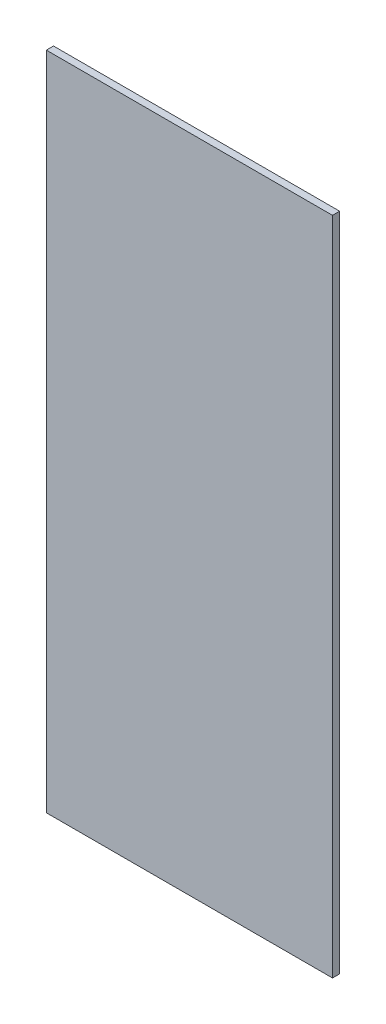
SolidWorks part; units mm, degrees
ref_plane "Alzado" through (0, 0, 0) normal (0, 0, 1) x (1, 0, 0)
ref_plane "Planta" through (0, 0, 0) normal (0, 1, 0) x (1, 0, 0)
ref_plane "Vista lateral" through (0, 0, 0) normal (1, 0, 0) x (0, 0, -1)
sketch "Croquis1" plane through (0, 0, 0) normal (0, 0, 1) x (1, 0, 0)
  line L1 (-300, 692.5) -> (300, 692.5)
  line L2 (-300, 692.5) -> (-300, -692.5)
  line L3 (-300, -692.5) -> (300, -692.5)
  line L4 (300, 692.5) -> (300, -692.5)
  line L5 (-300, 692.5) -> (300, -692.5) construction
  line L6 (-300, -692.5) -> (300, 692.5) construction
  point P0 (0, 0)
  dimension "D1" = 600
  dimension "D2" = 1385
extrude "Saliente-Extruir1" add sketch "Croquis1" along normal blind 15
